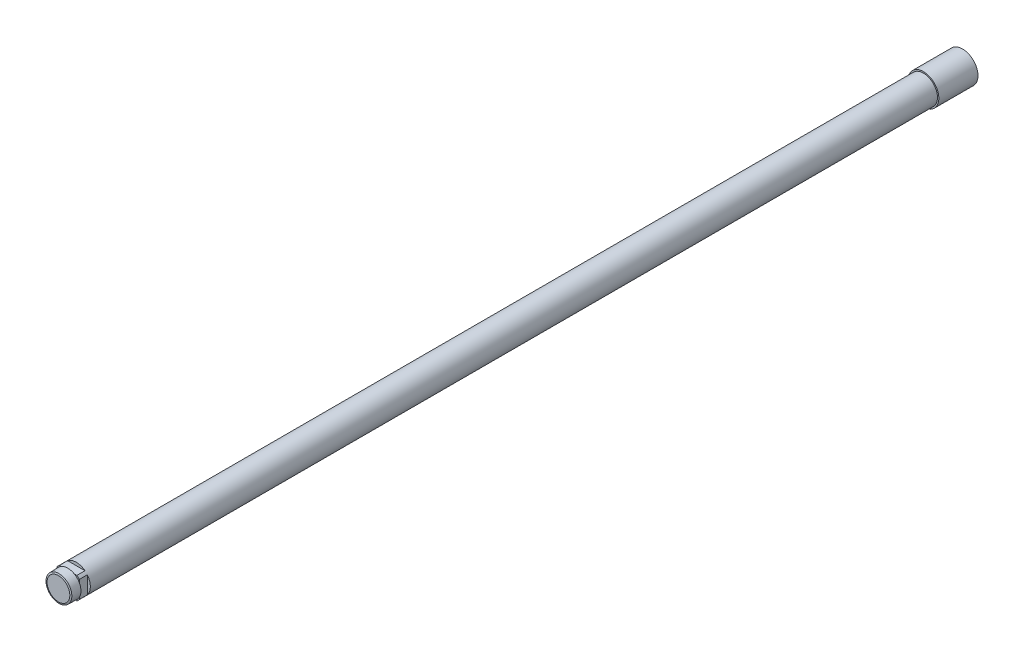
SolidWorks part; units mm, degrees
ref_plane "Front Plane" through (0, 0, 0) normal (0, 0, 1) x (1, 0, 0)
ref_plane "Top Plane" through (0, 0, 0) normal (0, 1, 0) x (1, 0, 0)
ref_plane "Right Plane" through (0, 0, 0) normal (1, 0, 0) x (0, 0, -1)
imported_body "Imported1"
sketch "Sketch1" plane through (0, 0, 0) normal (0, 0, 1) x (1, 0, 0)
  circle A1 centre (0, 0) radius 24.384
  circle A2 centre (0, 0) radius 24.384
  dimension "D1" = 0
extrude "Cut-Extrude1" cut sketch "Sketch1" along normal blind 0.0003
move or copy body "Body-Move/Copy1" bodies to move or copy 103 copy no translate (0, 0, -812.8)
sketch "Sketch2" plane through (0, 0, 0.0003) normal (0, 0, -1) x (-1, 0, 0)
  circle A0 centre (0, 0) radius 9.525 construction
  circle A1 centre (0, 0) radius 22.225
  circle A2 centre (0, 0) radius 22.225
  circle A3 centre (0, 0) radius 9.525
  dimension "D1" = 0
extrude "Boss-Extrude1" add sketch "Sketch2" along normal up to surface (812.8003 mm away)
